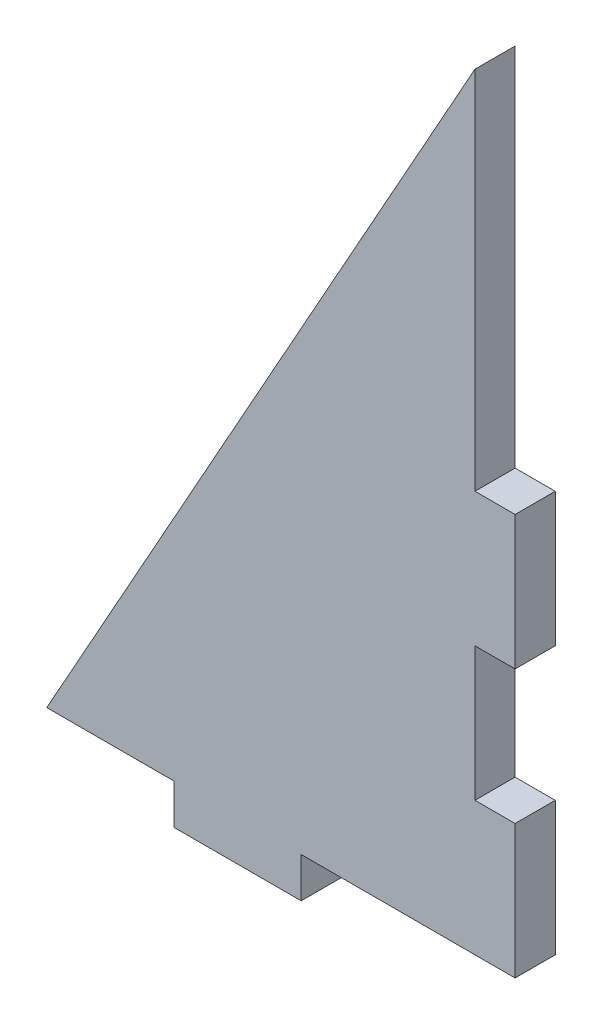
SolidWorks part; units mm, degrees
ref_plane "Plan de face" through (0, 0, 0) normal (0, 0, 1) x (1, 0, 0)
ref_plane "Plan de dessus" through (0, 0, 0) normal (0, 1, 0) x (1, 0, 0)
ref_plane "Plan de droite" through (0, 0, 0) normal (1, 0, 0) x (0, 0, -1)
sketch "Esquisse1" plane through (0, 0, 0) normal (0, 0, 1) x (1, 0, 0)
  line L1 (0, -20) -> (0, 230) construction
  line L3 (0, -17) -> (-100, -17) construction
  line L4 (-32, -17) -> (-22.4928, -17)
  line L5 (-22.4928, -17) -> (-22.4928, -20)
  line L6 (0, -20) -> (-100, -20) construction
  line L7 (-22.4928, -20) -> (-12.986, -20)
  line L8 (-12.986, -20) -> (-12.986, -17)
  line L9 (-12.986, -17) -> (0, -17)
  line L10 (0, -17) -> (3, -17)
  line L11 (3, -17) -> (3, -7)
  line L12 (3, -7) -> (0, -7)
  line L13 (0, -7) -> (0, 3)
  line L14 (0, 3) -> (3, 3)
  line L15 (3, 3) -> (3, 13)
  line L16 (3, 13) -> (0, 13)
  line L17 (0, 13) -> (0, 40.3164)
  line L19 (0, 40.3164) -> (-32, -17)
  dimension "D1" = 35
extrude "Boss.-Extru.1" add sketch "Esquisse1" along normal blind 3 contours L4 L5 L7 L8 L9 L10 L11 L12 L13 L14 L15 L16 L17 L19
